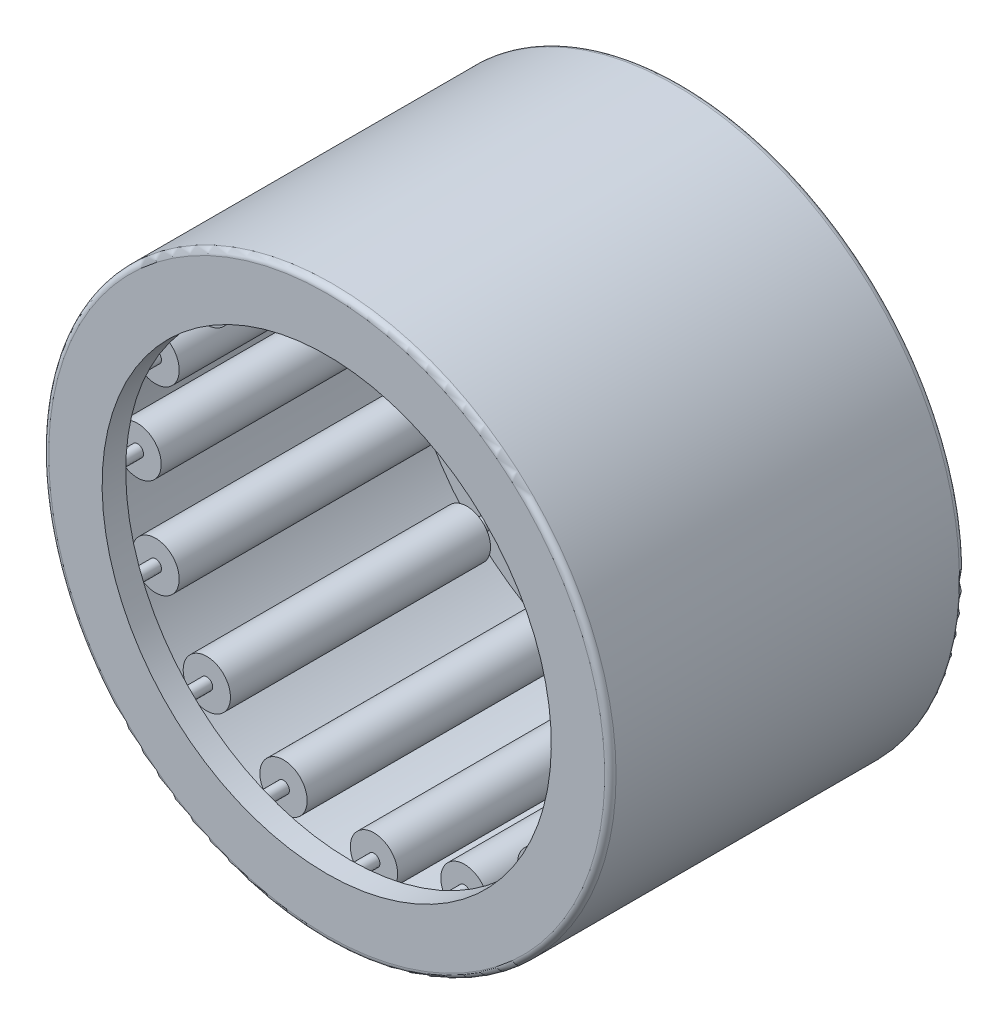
SolidWorks part; units mm, degrees
ref_plane "Front Plane" through (0, 0, 0) normal (0, 0, 1) x (1, 0, 0)
ref_plane "Top Plane" through (0, 0, 0) normal (0, 1, 0) x (1, 0, 0)
ref_plane "Right Plane" through (0, 0, 0) normal (1, 0, 0) x (0, 0, -1)
sketch "Sketch1" plane through (0, 0, 0) normal (1, 0, 0) x (0, 0, -1)
  line L0 (-7.9375, 0) -> (7.9375, 0) construction
  line L1 (0, 0) -> (0, 12.7) construction
  line L2 (-7.9375, 0) -> (-7.9375, 12.7) construction
  line L3 (-7.9375, 12.7) -> (7.9375, 12.7)
  line L4 (7.9375, 12.7) -> (7.9375, 0) construction
  line L5 (7.9375, 0) -> (6.8792, 0) construction
  line L6 (6.8792, 0) -> (6.8792, 11.6417) construction
  line L7 (6.8792, 11.6417) -> (-6.8792, 11.6417)
  line L8 (-6.8792, 11.6417) -> (-6.8792, 0) construction
  line L9 (-6.8792, 0) -> (-7.9375, 0) construction
  line L10 (-7.9375, 12.7) -> (-7.9375, 10.0542)
  line L11 (-7.9375, 10.0542) -> (-6.8792, 10.0542)
  line L12 (-6.8792, 10.0542) -> (-6.8792, 11.6417)
  line L13 (6.8792, 12.7) -> (6.8792, 11.6417) construction
  line L14 (6.8792, 11.6417) -> (6.8792, 10.0542)
  line L15 (6.8792, 10.0542) -> (7.9375, 10.0542)
  line L16 (7.9375, 10.0542) -> (7.9375, 12.7)
  line L17 (6.8792, 11.6417) -> (6.8792, 10.5833) construction
  line L18 (6.8792, 10.5833) -> (6.8792, 9.525) construction
  line L19 (6.8792, -11.6417) -> (6.8792, -10.5833) construction
  line L20 (6.8792, -12.7) -> (6.8792, -11.6417) construction
  line L21 (7.9375, -10.0542) -> (7.9375, -12.7) construction
  line L22 (6.8792, -10.0542) -> (7.9375, -10.0542) construction
  line L23 (6.8792, -11.6417) -> (6.8792, -10.0542) construction
  line L24 (-6.8792, -10.0542) -> (-6.8792, -11.6417) construction
  line L25 (-7.9375, -10.0542) -> (-6.8792, -10.0542) construction
  line L26 (-7.9375, -12.7) -> (-7.9375, -10.0542) construction
  line L27 (6.8792, -11.6417) -> (-6.8792, -11.6417) construction
  line L28 (-7.9375, -12.7) -> (7.9375, -12.7) construction
  point P5 (0, 9.525)
  dimension "Width" = 15.875
  dimension "OD" = 25.4
  dimension "Shaft Dia" = 19.05
revolve "Revolve1" add sketch "Sketch1" angle 360 about L0
sketch "Sketch2" plane through (0, 0, 0) normal (1, 0, 0) x (0, 0, -1)
  line L0 (6.8792, 11.6417) -> (-6.8792, 11.6417) construction
  line L1 (-5.8208, 10.5833) -> (5.8208, 10.5833) construction
  line L2 (-5.8208, 10.5833) -> (-5.8208, 11.6417) construction
  line L3 (-5.8208, 11.6417) -> (5.8208, 11.6417)
  line L4 (5.8208, 10.5833) -> (5.8208, 11.6417) construction
  line L5 (6.8792, 10.0542) -> (7.9375, 10.0542) construction
  line L6 (-6.8792, 10.5833) -> (-5.8208, 10.5833) construction
  line L7 (5.8208, 10.5833) -> (6.8792, 10.5833) construction
  line L8 (-7.9375, 10.0542) -> (-6.8792, 10.0542) construction
  line L9 (-5.8208, 10.8479) -> (-5.8208, 10.3188) construction
  line L10 (-6.8792, 10.5833) -> (-6.8792, 10.0542) construction
  line L11 (-5.8208, 11.6417) -> (-5.8208, 10.8479)
  line L12 (5.8208, 11.6417) -> (5.8208, 10.8479)
  line L13 (5.8208, 10.8479) -> (-5.8208, 10.8479)
  line L14 (0, 11.6417) -> (0, 9.525) construction
  line L15 (-6.8792, 10.0542) -> (-6.8792, 11.6417) construction
  line L16 (-5.8208, 10.3188) -> (-6.8792, 10.3188) construction
  line L17 (0, 0) -> (7.9375, 0) construction
  line L18 (-5.8208, -10.3188) -> (-6.8792, -10.3188) construction
  line L19 (0, -11.6417) -> (0, -9.525) construction
  line L20 (-6.8792, -10.5833) -> (-6.8792, -10.0542) construction
  line L21 (-5.8208, -10.8479) -> (-5.8208, -10.3188) construction
  line L22 (5.8208, -10.5833) -> (6.8792, -10.5833) construction
  line L23 (-6.8792, -10.5833) -> (-5.8208, -10.5833) construction
  line L24 (5.8208, -10.5833) -> (5.8208, -11.6417) construction
  line L25 (-5.8208, -10.5833) -> (-5.8208, -11.6417) construction
  line L26 (-5.8208, -10.5833) -> (5.8208, -10.5833) construction
  line L27 (5.8208, -10.8479) -> (-5.8208, -10.8479) construction
  line L28 (5.8208, -11.6417) -> (5.8208, -10.8479) construction
  line L29 (-5.8208, -11.6417) -> (-5.8208, -10.8479) construction
  line L30 (-5.8208, -11.6417) -> (5.8208, -11.6417) construction
  line L31 (7.9375, -12.7) -> (7.9375, 12.7) construction
  point P16 (0, 10.5833)
revolve "Revolve2" add sketch "Sketch2" angle 360 about L1
sketch "Sketch3" plane through (0, 0, 0) normal (1, 0, 0) x (0, 0, -1)
  line L0 (6.8792, 11.6417) -> (6.8792, 10.0542) construction
  line L1 (-6.8792, 10.5833) -> (6.8792, 10.5833)
  line L2 (-6.8792, 10.5833) -> (-6.8792, 10.8479)
  line L3 (-6.8792, 10.8479) -> (6.8792, 10.8479)
  line L4 (6.8792, 10.5833) -> (6.8792, 10.8479)
  line L5 (0, 0) -> (7.9375, 0) construction
  line L6 (7.9375, -12.7) -> (7.9375, 12.7) construction
  line L7 (6.8792, -10.5833) -> (6.8792, -10.8479) construction
  line L8 (-6.8792, -10.8479) -> (6.8792, -10.8479) construction
  line L9 (-6.8792, -10.5833) -> (-6.8792, -10.8479) construction
  line L10 (-6.8792, -10.5833) -> (6.8792, -10.5833) construction
revolve "Revolve3" add sketch "Sketch3" angle 360 about L1
ref_axis "Axis1" through (0, 0, -7.9375) along (0, 0, 1)
pattern_circular "CirPattern1" count 16 every 22.5 about axis through (0, 0, -7.9375) along (0, 0, 1)
fillet "Fillet1" radius 0.254 2 edges at (0, -12.7, -7.9375) (0, -12.7, 7.9375)
sketch "Sketch4" plane through (0, 0, 0) normal (1, 0, 0) x (0, 0, -1)
  line L1 (7.6835, 9.525) -> (5.8208, 9.525)
  line L2 (7.6835, 9.525) -> (7.6835, 10.0542)
  line L3 (7.6835, 10.0542) -> (5.8208, 10.0542)
  line L4 (5.8208, 9.525) -> (5.8208, 10.0542)
  line L5 (-7.9375, 10.0542) -> (-6.8792, 10.0542) construction
  line L6 (7.6835, -12.7) -> (7.6835, 12.7) construction
  line L7 (5.8208, 11.6417) -> (5.8208, 10.8479) construction
revolve "Revolve4" [suppressed] add sketch "Sketch4" angle 360 about L0
sketch "Sketch5" plane through (0, 0, 0) normal (1, 0, 0) x (0, 0, -1)
  line L0 (-7.6835, 12.7) -> (-7.6835, -12.7) construction
  line L1 (-5.8208, 9.525) -> (-7.6835, 9.525)
  line L2 (-5.8208, 9.525) -> (-5.8208, 10.0542)
  line L3 (-5.8208, 10.0542) -> (-7.6835, 10.0542)
  line L4 (-7.6835, 9.525) -> (-7.6835, 10.0542)
  line L6 (-5.8208, 11.6417) -> (-5.8208, 10.8479) construction
  line L7 (-7.9375, 10.0542) -> (-6.8792, 10.0542) construction
revolve "Revolve5" [suppressed] add sketch "Sketch5" angle 360 about L0
equation "\"Angle@CirPattern1\" = 360/\"Rollers@CirPattern1\""
equation "\"Rollers@CirPattern1\" = \"OD@Sketch1\"*16"
equation "\"D1@Fillet1\" = \"OD@Sketch1\"*.01"
